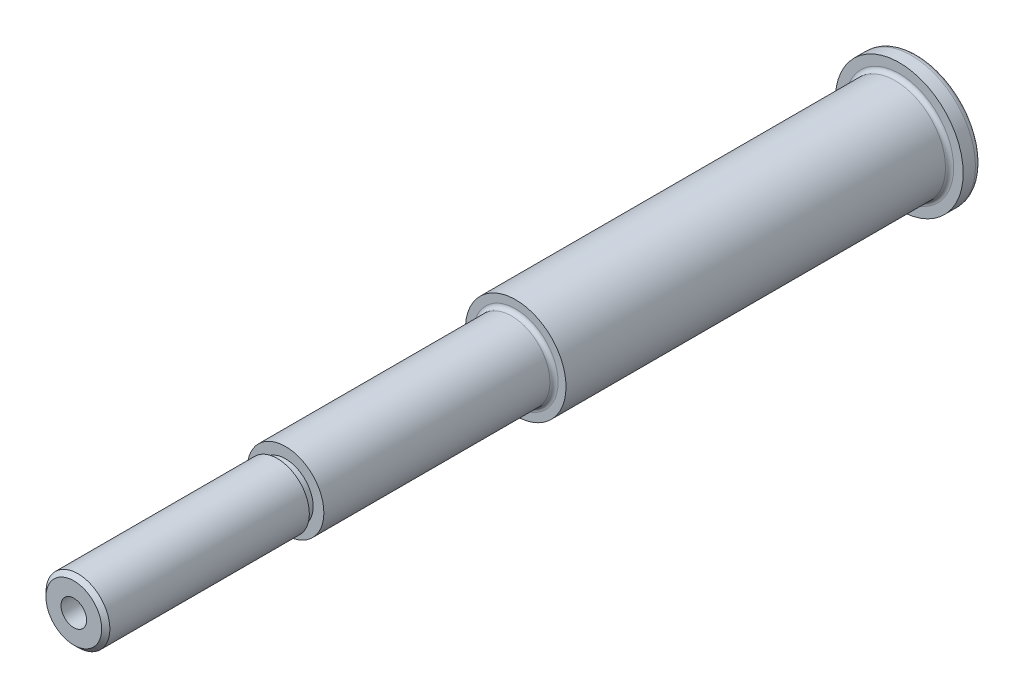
SolidWorks part; units mm, degrees
ref_plane "Front" through (0, 0, 0) normal (0, 0, 1) x (1, 0, 0)
ref_plane "Top" through (0, 0, 0) normal (0, 1, 0) x (1, 0, 0)
ref_plane "Right" through (0, 0, 0) normal (1, 0, 0) x (0, 0, -1)
sketch "Sketch2" plane through (0, 0, 0) normal (1, 0, 0) x (0, 0, -1)
  line L0 (0, 0) -> (8.2733, 0) construction
  line L1 (0, 0) -> (0, 14.351)
  line L2 (-1.524, 15.875) -> (-4.572, 15.875)
  line L3 (-4.572, 15.875) -> (-4.572, 13.5128)
  line L4 (-5.588, 12.4968) -> (-99.822, 12.4968)
  line L5 (-99.822, 12.4968) -> (-99.822, 10.5283)
  line L6 (-100.838, 9.5123) -> (-156.972, 9.5123)
  line L7 (-156.972, 9.5123) -> (-156.972, 6.858)
  line L8 (-156.972, 6.858) -> (-159.004, 6.858)
  line L9 (-159.004, 6.858) -> (-159.004, 7.9375)
  line L10 (-159.004, 7.9375) -> (-208.534, 7.9375)
  line L11 (-209.55, 6.9215) -> (-209.55, 0)
  line L12 (-209.55, 0) -> (0, 0)
  line L13 (-208.534, 7.9375) -> (-209.55, 6.9215)
  arc A0 (-100.838, 9.5123) -> (-99.822, 10.5283) centre (-100.838, 10.5283) ccw
  arc A1 (-1.524, 15.875) -> (0, 14.351) centre (-1.524, 14.351) cw
  arc A2 (-5.588, 12.4968) -> (-4.572, 13.5128) centre (-5.588, 13.5128) ccw
  point P12 (-209.55, 7.9375)
  point P20 (0, 15.875)
  point P23 (-4.572, 12.4968)
  dimension "D2" = 1.016
  dimension "D14" = 1.524
  dimension "D1" = 31.75
  dimension "D3" = 24.9936
  dimension "D4" = 4.572
  dimension "D5" = 19.0246
  dimension "D6" = 209.55
  dimension "D7" = 95.25
  dimension "D8" = 57.15
  dimension "D9" = 13.716
  dimension "D10" = 2.032
  dimension "D11" = 15.875
  dimension "D12" = 1.016
  dimension "D13" = 45
revolve "Base-Revolve" add sketch "Sketch2" angle 360 about L0
sketch "Sketch3" plane through (0, 0, 209.55) normal (0, 0, 1) x (1, 0, 0)
  circle A0 centre (0, 0) radius 3.175
  dimension "D1" = 6.35
extrude "Cut-Extrude1" cut sketch "Sketch3" against normal blind 34.925
